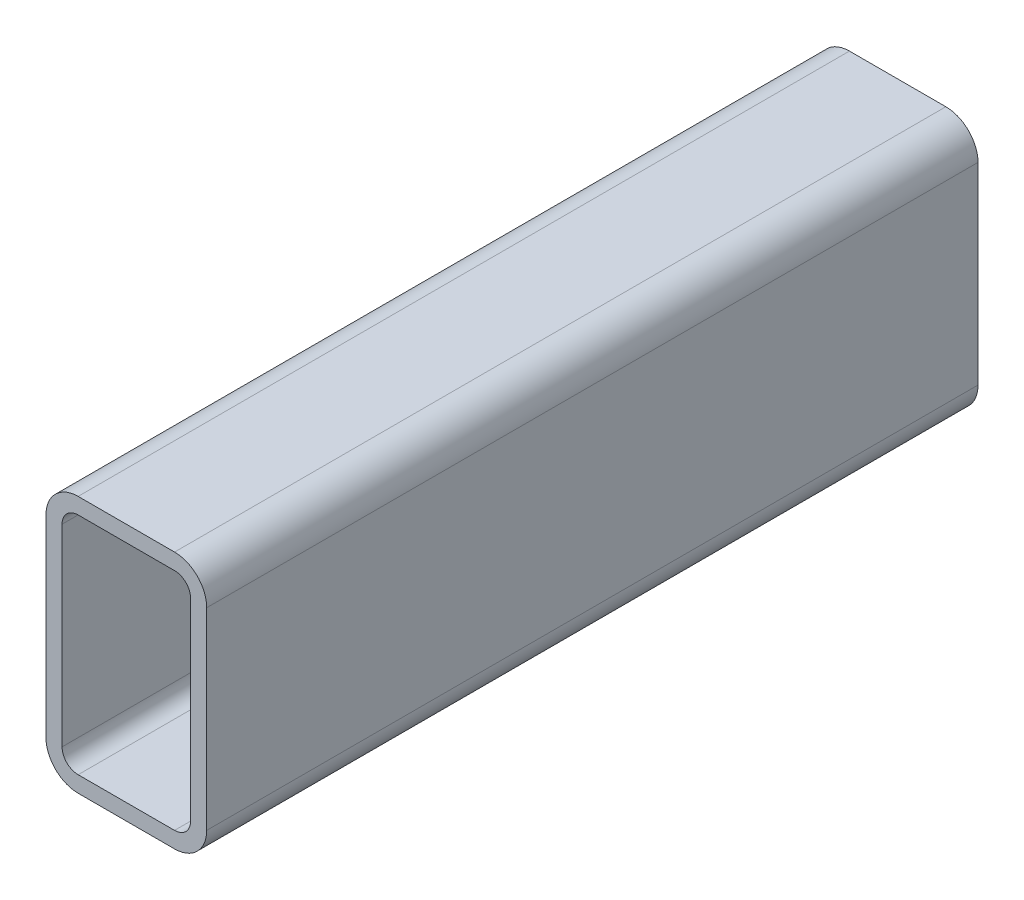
SolidWorks part; units mm, degrees
ref_plane "Front Plane" through (0, 0, 0) normal (0, 0, 1) x (1, 0, 0)
ref_plane "Top Plane" through (0, 0, 0) normal (0, 1, 0) x (1, 0, 0)
ref_plane "Right Plane" through (0, 0, 0) normal (1, 0, 0) x (0, 0, -1)
sketch "Sketch1" plane through (0, 0, 0) normal (0, 0, 1) x (1, 0, 0)
sketch_block_instance "HSS4x2.5x0.250-1"
sketch_block "HSS4x2.5x0.250"
extrude "Boss-Extrude1" add sketch "Sketch1" along normal blind 304.8
